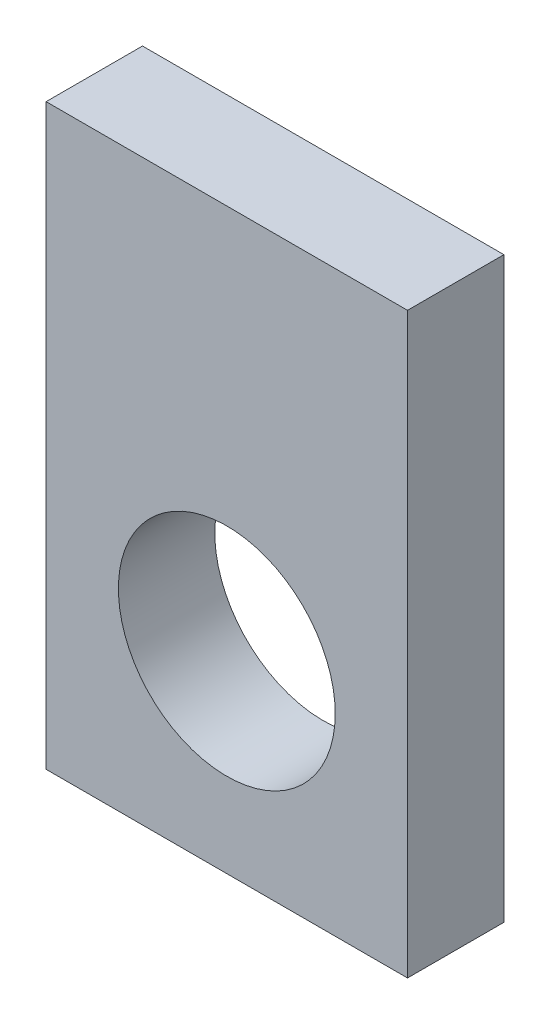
SolidWorks part; units mm, degrees
ref_plane "Plan de face" through (0, 0, 0) normal (0, 0, 1) x (1, 0, 0)
ref_plane "Plan de dessus" through (0, 0, 0) normal (0, 1, 0) x (1, 0, 0)
ref_plane "Plan de droite" through (0, 0, 0) normal (1, 0, 0) x (0, 0, -1)
sketch "Esquisse1" plane through (0, 0, 0) normal (0, 0, 1) x (1, 0, 0)
  line L0 (7.5, 24) -> (7.5, 0) construction
  line L1 (0, 0) -> (15, 0)
  line L2 (0, 0) -> (0, 24)
  line L3 (0, 24) -> (15, 24)
  line L4 (15, 0) -> (15, 24)
  circle A0 centre (7.5, 8) radius 4.5
  dimension "D3" = 9
  dimension "D1" = 24
  dimension "D2" = 15
  dimension "D4" = 8
extrude "Extrusion1" add sketch "Esquisse1" along normal blind 4
